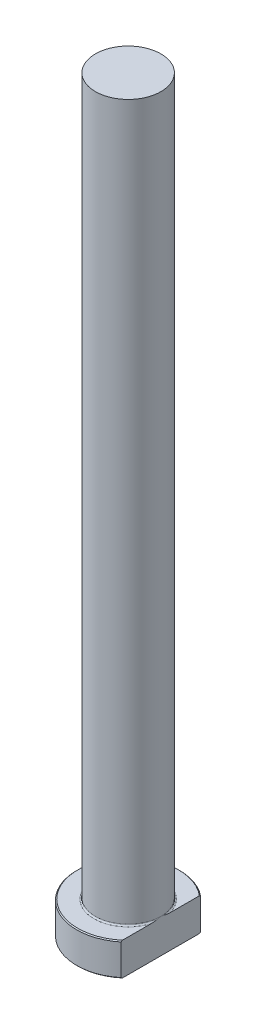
SolidWorks part; units mm, degrees
ref_plane "Front Plane" through (0, 0, 0) normal (0, 0, 1) x (1, 0, 0)
ref_plane "Top Plane" through (0, 0, 0) normal (0, 1, 0) x (1, 0, 0)
ref_plane "Right Plane" through (0, 0, 0) normal (1, 0, 0) x (0, 0, -1)
sketch "Sketch1" plane through (0, 0, 0) normal (0, 0, 1) x (1, 0, 0)
  line L0 (0, 259.9588) -> (0, -15.1925) construction
  line L1 (0, 0) -> (-11, 0)
  line L2 (-11, 0) -> (-11, 7)
  line L3 (-11, 7) -> (-7, 7)
  line L4 (-7, 7) -> (-7, 160)
  line L5 (-7, 160) -> (0, 160)
  line L6 (0, 160) -> (0, 0)
  dimension "L" = 160
  dimension "H" = 22
  dimension "T" = 7
  dimension "D" = 14
revolve "Revolve1" add sketch "Sketch1" angle 360 about L0
chamfer "Chamfer1" distance 0.2 angle 45 2 edges at (0, 7, 11) (0, 0, 11)
fillet "Fillet1" radius 0.3 1 edges at (0, 7, 7)
sketch "Sketch2" plane through (0, 0, 0) normal (0, 1, 0) x (1, 0, 0)
  line L0 (7, 8.4853) -> (7, -8.4853)
  circle A0 centre (0, 0) radius 11 construction
  arc A1 (7, -8.4853) -> (7, 8.4853) centre (0, 0) ccw
  circle A2 centre (0, 0) radius 7 construction
extrude "KEY" cut sketch "Sketch2" along normal through all
